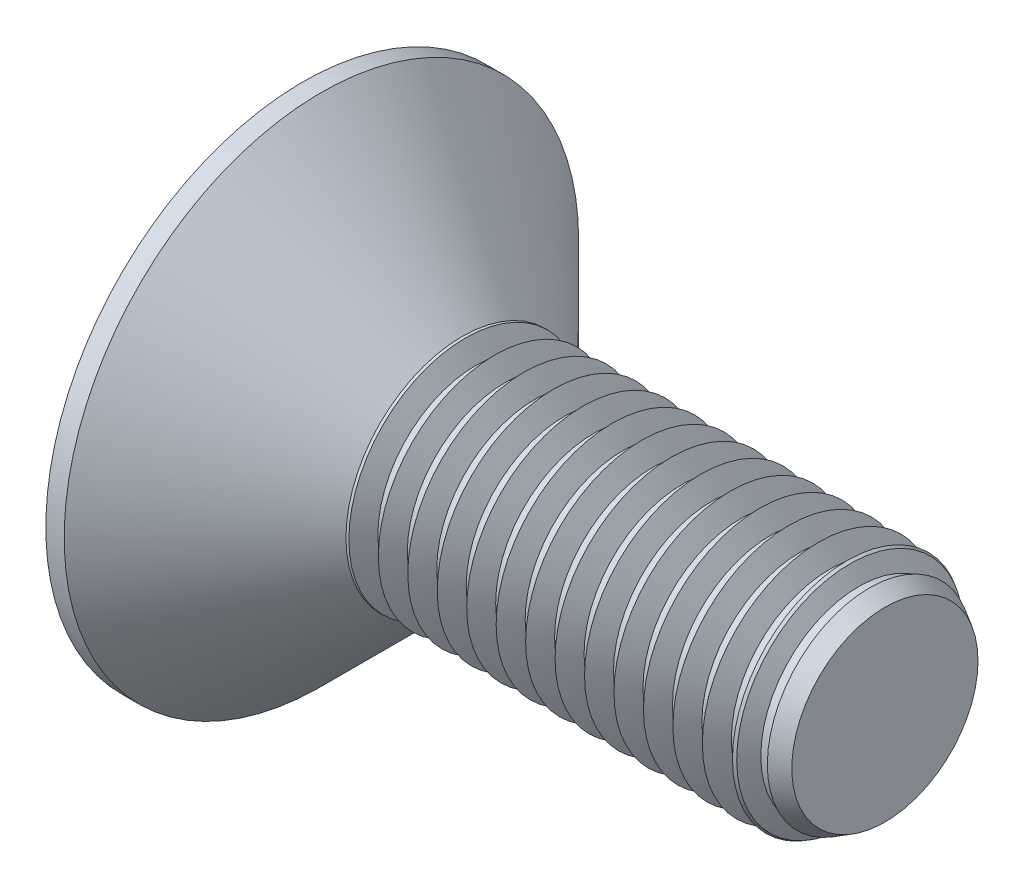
SolidWorks part; units mm, degrees
ref_plane "Front" through (0, 0, 0) normal (0, 0, 1) x (1, 0, 0)
ref_plane "Top" through (0, 0, 0) normal (0, 1, 0) x (1, 0, 0)
ref_plane "Right" through (0, 0, 0) normal (1, 0, 0) x (0, 0, -1)
sketch "Sketch1" plane through (0, 0, 0) normal (0, 0, 1) x (1, 0, 0)
  line L0 (0, 4.2) -> (0.3, 4.2)
  line L1 (0.3, 4.2) -> (2.6, 1.9)
  line L2 (2.6, 1.9) -> (9.5, 1.9)
  line L3 (9.5, 1.9) -> (9.5, 0)
  line L4 (9.5, 0) -> (0, 0)
  line L5 (0, 0) -> (0, 4.2)
  line L6 (6.6207, 0) -> (-0.9387, 0) construction
  dimension "D1" = 45
  dimension "d" = 3.8
  dimension "dK" = 8.4
  dimension "k" = 2.6
  dimension "l" = 9.5
revolve "Revolve1" add sketch "Sketch1" angle 360 about L6
chamfer "Chamfer1" distance 0.38 angle 60 1 edges at (9.5, 0, -1.9)
sketch "Sketch9" plane through (0, 0, 0) normal (0, 0, 1) x (1, 0, 0)
  line L0 (2.9558, 1.6) -> (2.8213, 1.6)
  line L1 (2.8213, 1.6) -> (2.6481, 1.9)
  line L2 (2.9558, 1.6) -> (3.129, 1.9)
  line L3 (2.6481, 1.9) -> (2.6481, 2.15)
  line L4 (3.129, 1.9) -> (3.129, 2.15)
  line L5 (2.6481, 2.15) -> (3.129, 2.15)
  line L6 (2.8886, 1.6) -> (2.8886, 0) construction
  line L7 (0, 0) -> (7.3035, 0) construction
  line L8 (2.6, 1.9) -> (2.6, -1.9) construction
  line L9 (8.8418, 1.9) -> (2.6, 1.9) construction
  dimension "D2" = 60
  dimension "D3" = 0.25
  dimension "threadstart" = 0.2886
  dimension "minordia" = 3.2
  dimension "advance" = 0.4809
revolve "ThreadSchematic" cut sketch "Sketch9" angle 360 about L7
pattern_linear "ThdSchPat" count 15 spacing 0.4809 along (1, 0, 0) of "ThreadSchematic"
sketch "Sketch3" plane through (0, 0, 0) normal (0, 0, 1) x (1, 0, 0)
  line L0 (2.6, 1.9) -> (9.5, 1.9) construction
  line L2 (7.5, 1.9) -> (8, 1.9) construction
  line L3 (9.5, 1.9) -> (9.5, 0) construction
  line L4 (8, 1.9) -> (9.5, 1.9)
  line L5 (2.9, 0) -> (5.4301, 0) construction
  line L6 (9.5, 0) -> (9.7, 0)
  line L7 (9.7, 0) -> (9.7, 1.9)
  line L8 (9.7, 1.9) -> (9.5, 1.9)
  line L9 (8, 1.9) -> (9.5, 0)
  dimension "D1" = 0.5
  dimension "y" = 2
  dimension "D2" = 0.2
revolve "EndCone" [suppressed] cut sketch "Sketch3" angle 360 about L5
sketch "Sketch4" plane through (0, 0, 0) normal (-1, 0, 0) x (0, 0, 1)
  line L0 (-0.25, 1) -> (-0.25, 0.25)
  line L1 (-0.25, 1) -> (0.25, 1)
  line L2 (-1, 0.25) -> (-1, -0.25)
  line L3 (-0.25, -1) -> (0.25, -1)
  line L4 (1, 0.25) -> (1, -0.25)
  line L5 (0.25, 1) -> (0.25, 0.25)
  line L6 (0.25, 0.25) -> (1, 0.25)
  line L7 (0.25, -0.25) -> (1, -0.25)
  line L8 (0.25, -0.25) -> (0.25, -1)
  line L9 (-0.25, -0.25) -> (-0.25, -1)
  line L10 (-0.25, -0.25) -> (-1, -0.25)
  line L11 (-0.25, 0.25) -> (-1, 0.25)
  line L12 (1, 0) -> (-1, 0) construction
  dimension "D1" = 0.5
  dimension "m" = 2
extrude "Cut-Extrude1" cut sketch "Sketch4" against normal blind 1.2
draft "Draft1" type of draft neutral plane draft angle 35 faces to draft 4 parameters "D1"=35
draft "Draft2" type of draft neutral plane draft angle 8 faces to draft 8 parameters "D1"=8
sketch "Sketch6" plane through (1.2, 0, 0) normal (-1, 0, 0) x (0, 0, 1)
  line L0 (0.0814, 0.0814) -> (0.0814, 0.1598) construction
  line L1 (0.1598, 0.0814) -> (0.0814, 0.0814) construction
  line L2 (-0.0814, 0.1598) -> (-0.0814, 0.0814) construction
  line L3 (-0.0814, 0.0814) -> (-0.1598, 0.0814) construction
  line L4 (-0.1598, -0.0814) -> (-0.0814, -0.0814) construction
  line L5 (-0.0814, -0.0814) -> (-0.0814, -0.1598) construction
  line L6 (0.0814, -0.1598) -> (0.0814, -0.0814) construction
  line L7 (0.0814, -0.0814) -> (0.1598, -0.0814) construction
  line L9 (-0.1206, 0.0814) -> (-0.1206, -0.0814)
  line L10 (-0.0814, -0.1206) -> (0.0814, -0.1206)
  line L11 (0.1206, -0.0814) -> (0.1206, 0.0814)
  line L12 (0.0814, 0.1206) -> (-0.0814, 0.1206)
  arc A0 (0.0814, 0.1206) -> (0.1206, 0.0814) centre (0.1206, 0.1206) ccw
  arc A1 (-0.0814, 0.1206) -> (-0.1206, 0.0814) centre (-0.1206, 0.1206) cw
  arc A2 (-0.1206, -0.0814) -> (-0.0814, -0.1206) centre (-0.1206, -0.1206) cw
  arc A3 (0.0814, -0.1206) -> (0.1206, -0.0814) centre (0.1206, -0.1206) cw
sketch "Sketch7" plane through (0, 0, 0) normal (-1, 0, 0) x (0, 0, 1)
  line L8 (0.25, 0.25) -> (0.25, 1) construction
  line L9 (1, 0.25) -> (0.25, 0.25) construction
  line L10 (0.25, -0.25) -> (1, -0.25) construction
  line L11 (0.25, -1) -> (0.25, -0.25) construction
  line L12 (-0.25, 1) -> (-0.25, 0.25) construction
  line L13 (-0.25, 0.25) -> (-1, 0.25) construction
  line L14 (-1, -0.25) -> (-0.25, -0.25) construction
  line L15 (-0.25, -0.25) -> (-0.25, -1) construction
  line L16 (0.2892, 0.25) -> (0.2892, -0.25)
  line L17 (0.25, -0.2892) -> (-0.25, -0.2892)
  line L18 (-0.2892, -0.25) -> (-0.2892, 0.25)
  line L19 (-0.25, 0.2892) -> (0.25, 0.2892)
  arc A0 (0.25, 0.2892) -> (0.2892, 0.25) centre (0.2892, 0.2892) ccw
  arc A1 (-0.25, 0.2892) -> (-0.2892, 0.25) centre (-0.2892, 0.2892) cw
  arc A2 (-0.2892, -0.25) -> (-0.25, -0.2892) centre (-0.2892, -0.2892) cw
  arc A3 (0.0814, 0.1206) -> (0.1206, 0.0814) centre (0.1206, 0.1206) ccw construction
  arc A4 (0.2892, -0.25) -> (0.25, -0.2892) centre (0.2892, -0.2892) ccw
loft "Cut-Loft1" cut profiles "Sketch6", "Sketch7"
sketch "Sketch8" plane through (0, 0, 0) normal (-1, 0, 0) x (0, 0, 1)
  line L0 (0, 0) -> (1, 1) construction
  line L1 (0.0814, 0.1206) -> (1, 1)
  line L2 (1, 1) -> (0.1206, 0.0814)
  line L3 (0.25, 1) -> (1, 1) construction
  line L4 (1, 1) -> (1, 0.25) construction
  line L5 (0, 0) -> (0.1206, 0) construction
  line L6 (0.1206, 0.0814) -> (0.1206, 0)
  line L7 (0.0814, 0.1206) -> (0, 0.1206)
  line L8 (0, 0.1206) -> (0, 0) construction
  line L9 (0.0814, -0.1206) -> (0, -0.1206)
  line L10 (1, -1) -> (0.0814, -0.1206)
  line L11 (0.1206, -0.0814) -> (1, -1)
  line L12 (0.1206, -0.0814) -> (0.1206, 0)
  line L13 (-0.1206, -0.0814) -> (-0.1206, 0)
  line L14 (-1, -1) -> (-0.1206, -0.0814)
  line L15 (-0.0814, -0.1206) -> (-1, -1)
  line L16 (-0.0814, -0.1206) -> (0, -0.1206)
  line L17 (-0.0814, 0.1206) -> (0, 0.1206)
  line L18 (-1, 1) -> (-0.0814, 0.1206)
  line L19 (-0.1206, 0.0814) -> (-1, 1)
  line L20 (-0.1206, 0.0814) -> (-0.1206, 0)
  arc A1 (0.0814, 0.1206) -> (0.1206, 0.0814) centre (0.1206, 0.1206) ccw construction
  arc A2 (0.0814, 0.1206) -> (0.1206, 0.0814) centre (0.1206, 0.1206) ccw construction
extrude "TypeZ" [suppressed] cut sketch "Sketch8" against normal blind 0.24 draft 3
equation "\"D1@Chamfer1\" = \"d@Sketch1\" / 10"
equation "\"D1@Sketch4\" = \"m@Sketch4\" / 4"
equation "\"D1@TypeZ\" = \"p@Cut-Extrude1\"*0.2"
equation "\"D1@Sketch3\" = \"y@Sketch3\" / 4"
equation "\"threadstart@Sketch9\"=\"advance@Sketch9\"*0.6"
equation "\"D1@ThdSchPat\" = int(((\"l@Sketch1\"-\"k@Sketch1\")/\"advance@Sketch9\") + 0.999)"
equation "\"D3@ThdSchPat\" = \"advance@Sketch9\""
equation "\"minordia@sketch9\" = \"d2@threadcosmetic\""
